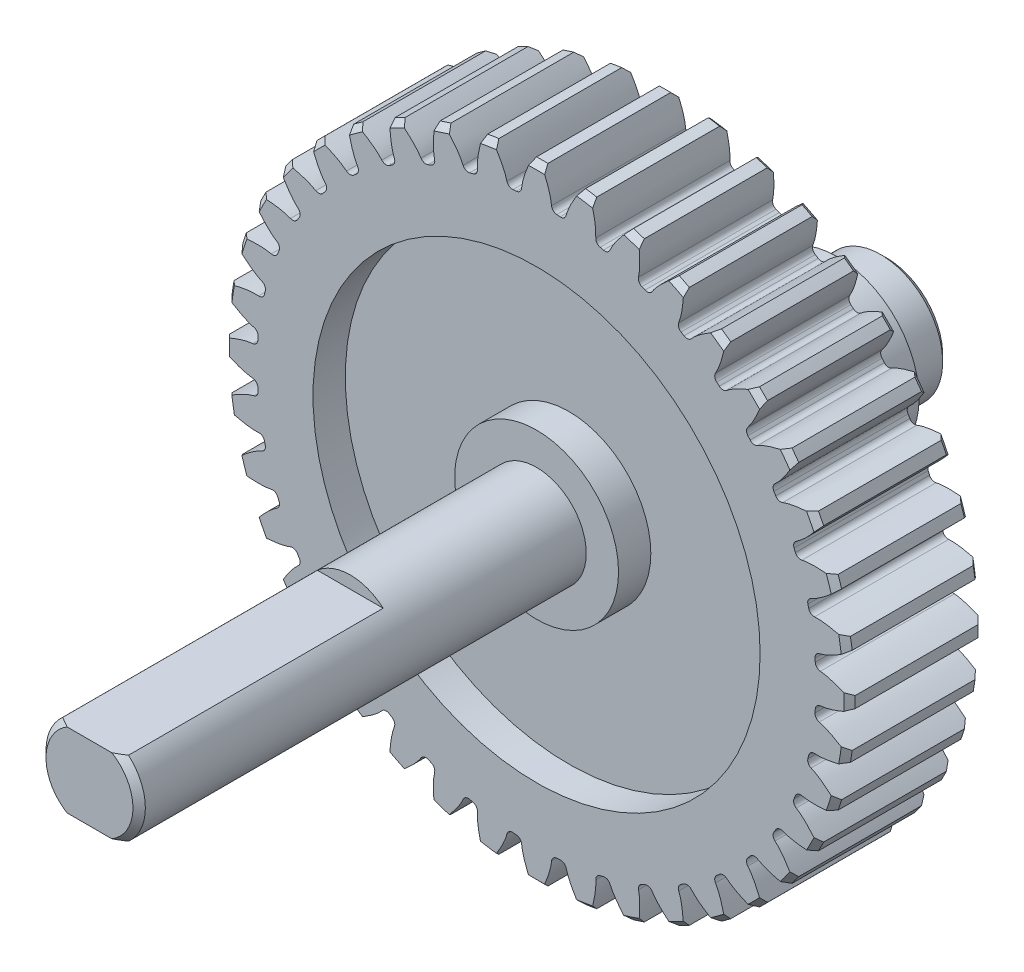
SolidWorks part; units mm, degrees
ref_plane "Face" through (0, 0, 0) normal (0, 0, 1) x (1, 0, 0)
ref_plane "Dessus" through (0, 0, 0) normal (0, 1, 0) x (1, 0, 0)
ref_plane "Droite" through (0, 0, 0) normal (1, 0, 0) x (0, 0, -1)
sketch "Dent" plane through (0, 0, 0) normal (0, 0, 1) x (1, 0, 0)
  line L1 (-0.2283, 9.9216) -> (0, 9.2943)
  line L3 (0, 12.6) -> (0, -12.6) construction
  line L4 (0, 0) -> (0.2283, 12.5979) construction
  line L5 (0.4712, 11.9907) -> (-0.4712, 11.9907) construction
  line L6 (0.6107, 11.2598) -> (-0.6107, 11.2598) construction
  line L7 (-0.3, 0) -> (0.3, 0) construction
  line L9 (0.2283, 9.9216) -> (0, 9.2943)
  line L11 (0, 0) -> (0.4712, 11.9907) construction
  line L12 (0, 0) -> (0.6107, 11.2598) construction
  circle A0 centre (0, 0) radius 12 construction
  circle A1 centre (0, 0) radius 12.6 construction
  arc A2 (0.2283, 12.5979) -> (-0.2283, 12.5979) centre (0, 0) ccw
  circle A3 centre (0, 0) radius 11.2763 construction
  point P2 (-0.4712, 11.9907)
  point P3 (-0.6107, 11.2598)
  point P19 (0.4712, 11.9907)
  point P20 (0.6107, 11.2598)
  dimension "Dp" = 24
  dimension "Dt" = 25.2
  dimension "Db" = 22.5526
  dimension "Module" = 0.6
  dimension "Angle de pression" = 20
  dimension "Ep au primitif" = 0.9425
  dimension "D3" = 2.066
  dimension "D4" = 0.854
sketch "Esquisse1" plane through (0, 0, 0) normal (0, 0, 1) x (1, 0, 0)
  circle A0 centre (0, 0) radius 11.25
  dimension "Dpied" = 22.5
extrude "Base-Extrusion" add sketch "Esquisse1" against normal mid plane 5.4
extrude "Boss.-Extru.1" add sketch "Dent" against normal mid plane 5.4
fillet "Congé1" radius 0.228 4 edges at (0.6103, 11.2334, 0) (-0.6103, 11.2334, 0)
chamfer "Chanfrein1" distance 0.228 angle 45 4 edges at (0, 12.6, -2.7) (0, 12.6, 2.7)
pattern_circular "Répétition circulaire1" count 40 over 360 of "Congé1", "Boss.-Extru.1", "Chanfrein1"
sketch "Esquisse2" plane through (0, 0, -2.7) normal (0, 0, -1) x (-1, 0, 0)
  circle A0 centre (0, 0) radius 9
  circle A1 centre (0, 0) radius 5
  dimension "D1" = 18
  dimension "D2" = 10
extrude "Enlèv. mat.-Extru.1" cut sketch "Esquisse2" against normal blind 1.3
sketch "Esquisse3" plane through (0, 0, 2.7) normal (0, 0, 1) x (1, 0, 0)
  circle A0 centre (0, 0) radius 9 construction
  circle A1 centre (0, 0) radius 9
  circle A2 centre (0, 0) radius 3.3
  dimension "D1" = 6.6
extrude "Enlèv. mat.-Extru.2" cut sketch "Esquisse3" against normal blind 1.3
sketch "Esquisse4" plane through (0, 0, -2.7) normal (0, 0, -1) x (-1, 0, 0)
  circle A0 centre (0, 0) radius 3.3
  dimension "D1" = 6.6
extrude "Boss.-Extru.2" add sketch "Esquisse4" along normal blind 6.7
sketch "Esquisse5" plane through (0, 0, -9.4) normal (0, 0, -1) x (-1, 0, 0)
  circle A0 centre (0, 0) radius 2.5
  dimension "D1" = 5
extrude "Boss.-Extru.3" add sketch "Esquisse5" along normal blind 2
sketch "Esquisse6" plane through (0, 0, 2.7) normal (0, 0, 1) x (1, 0, 0)
  circle A0 centre (0, 0) radius 2
  dimension "D1" = 4
extrude "Boss.-Extru.4" add sketch "Esquisse6" along normal blind 18
chamfer "Chanfrein2" distance 0.25 angle 45 2 edges at (2, 0, 20.7) (-2.5, 0, -11.4)
sketch "Esquisse7" plane through (0, 0, 0) normal (1, 0, 0) x (0, 0, -1)
  line L0 (0, 0) -> (-23.1736, 0) construction
  line L1 (2.7, 0) -> (-2.7, 0) construction
  line L2 (-20.7, 1.75) -> (-20.7, -1.75) construction
  line L3 (-20.7, 2) -> (-10.2, 2)
  line L4 (-20.7, 2) -> (-20.7, 1.5)
  line L5 (-20.7, 1.5) -> (-10.2, 1.5)
  line L6 (-10.2, 2) -> (-10.2, 1.5)
  line L7 (-10.2, -2) -> (-10.2, -1.5)
  line L8 (-20.7, -1.5) -> (-10.2, -1.5)
  line L9 (-20.7, -2) -> (-20.7, -1.5)
  line L10 (-20.7, -2) -> (-10.2, -2)
  line L11 (-2.7, 2) -> (-20.45, 2) construction
  dimension "D1" = 10.5
  dimension "D2" = 3
extrude "Enlèv. mat.-Extru.3" cut sketch "Esquisse7" against normal through all and the other way through all
sketch "Diamètre primitif" plane through (0, 0, 0) normal (0, 0, 1) x (1, 0, 0)
  circle A0 centre (0, 0) radius 12
  dimension "D1" = 24
